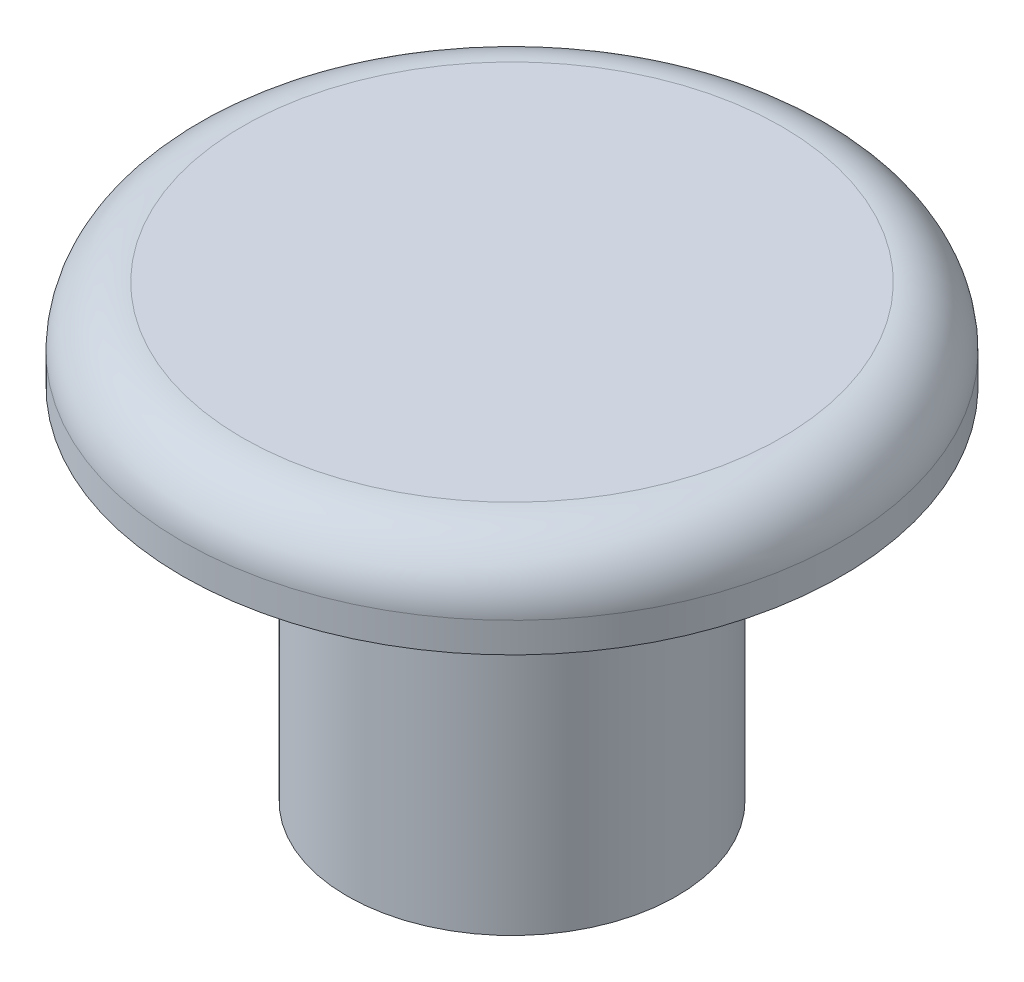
SolidWorks part; units mm, degrees
ref_plane "Front Plane" through (0, 0, 0) normal (0, 0, 1) x (1, 0, 0)
ref_plane "Top Plane" through (0, 0, 0) normal (0, 1, 0) x (1, 0, 0)
ref_plane "Right Plane" through (0, 0, 0) normal (1, 0, 0) x (0, 0, -1)
sketch "Sketch1" plane through (0, 0, 0) normal (0, 0, 1) x (1, 0, 0)
  line L0 (0, 0) -> (0, -29.8315) construction
  line L1 (0, 0) -> (5.5, 0)
  line L2 (5.5, 0) -> (5.5, 12)
  line L3 (5.5, 12) -> (11, 12)
  line L4 (11, 12) -> (11, 15)
  line L5 (11, 15) -> (0, 15)
  line L6 (0, 15) -> (0, 0)
  dimension "D1" = 12
  dimension "D2" = 3
  dimension "D3" = 11
  dimension "D4" = 22
revolve "Revolve1" add sketch "Sketch1" angle 360 about L0
fillet "Fillet1" radius 2 1 edges at (0, 15, 11)
